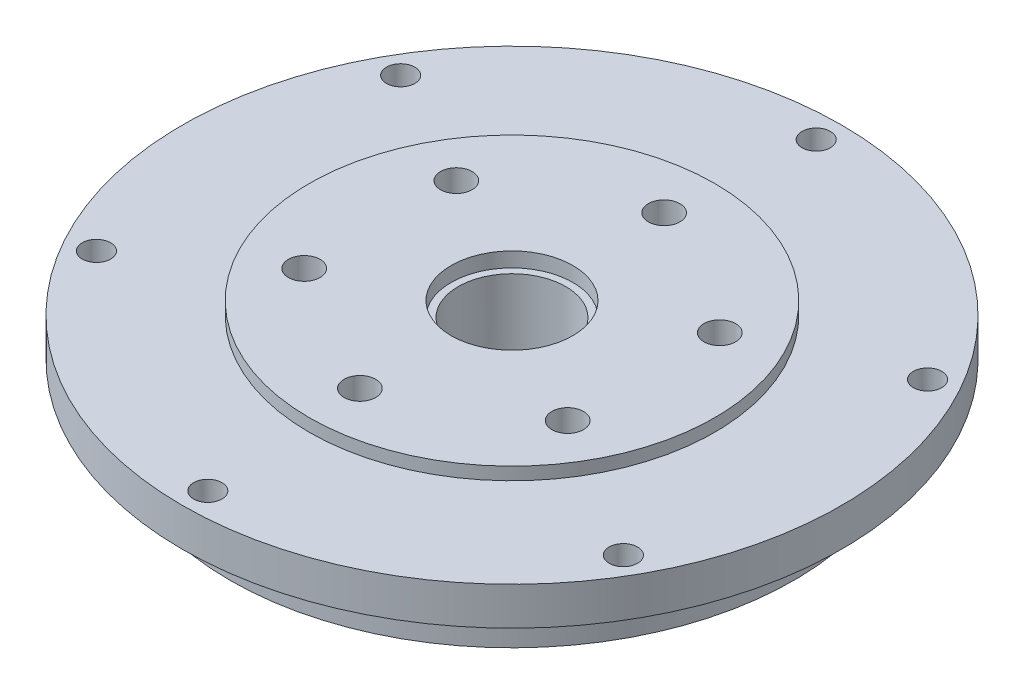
SolidWorks part; units mm, degrees
ref_plane "Front Plane" through (0, 0, 0) normal (0, 0, 1) x (1, 0, 0)
ref_plane "Top Plane" through (0, 0, 0) normal (0, 1, 0) x (1, 0, 0)
ref_plane "Right Plane" through (0, 0, 0) normal (1, 0, 0) x (0, 0, -1)
sketch "Sketch1" plane through (0, 0, 0) normal (0, 0, 1) x (1, 0, 0)
  line L0 (0, 77.3658) -> (0, -62.8959) construction
  line L1 (13.462, 21.717) -> (15.24, 21.717)
  line L2 (13.462, 0) -> (13.462, 21.717)
  line L3 (15.24, 21.717) -> (15.24, 25.4)
  line L4 (50.8, 25.4) -> (15.24, 25.4)
  line L6 (50.8, 25.4) -> (50.8, 22.225)
  line L7 (50.8, 22.225) -> (82.55, 22.225)
  line L8 (82.55, 22.225) -> (82.55, 12.7)
  line L9 (82.55, 12.7) -> (70.612, 12.7)
  line L10 (70.612, 12.7) -> (70.612, 8.8138)
  line L11 (70.612, 8.8138) -> (67.564, 8.8138)
  line L12 (67.564, 8.8138) -> (67.564, 4.7498)
  line L13 (67.564, 4.7498) -> (70.612, 4.7498)
  line L14 (70.612, 4.7498) -> (70.612, 0)
  line L15 (70.612, 0) -> (13.462, 0)
  dimension "D1" = 13.462
  dimension "D2" = 15.24
  dimension "D3" = 25.4
  dimension "D4" = 3.683
  dimension "D7" = 3.175
  dimension "D8" = 50.8
  dimension "D9" = 82.55
  dimension "D10" = 9.525
  dimension "D11" = 4.064
  dimension "D12" = 70.612
  dimension "D13" = 3.048
  dimension "D14" = 4.7498
revolve "Revolve1" add sketch "Sketch1" angle 360 about L0
sketch "Sketch2" plane through (0, 22.225, 0) normal (0, 1, 0) x (-1, 0, 0)
  circle A0 centre (0, -76.2) radius 3.556
  dimension "D1" = 7.112
  dimension "D2" = 76.2
extrude "Cut-Extrude1" cut sketch "Sketch2" against normal through all
pattern_circular "CirPattern1" count 6 over 360 about axis through (0, 0, 0) along (0, 1, 0) of "Cut-Extrude1"
sketch "Sketch3" plane through (0, 25.4, 0) normal (0, 1, 0) x (-1, 0, 0)
  circle A0 centre (0, -38.1) radius 3.9624
  dimension "D1" = 7.9248
  dimension "D2" = 38.1
extrude "Cut-Extrude2" cut sketch "Sketch3" against normal blind 19.05
pattern_circular "CirPattern2" count 6 over 360 about axis through (0, 0, 0) along (0, 1, 0) of "Cut-Extrude2"
sketch "Sketch4" plane through (0, 0, 0) normal (0, -1, 0) x (1, 0, 0)
  circle A0 centre (57.15, 0) radius 3.9624
  dimension "D1" = 7.9248
  dimension "D2" = 57.15
extrude "Cut-Extrude3" cut sketch "Sketch4" against normal blind 19.05
pattern_circular "CirPattern3" count 6 over 360 about axis through (0, 0, 0) along (0, 1, 0) of "Cut-Extrude3"
sketch "Sketch6" plane through (0, 0, 0) normal (0, -1, 0) x (1, 0, 0)
  circle A0 centre (0, 0) radius 63.5635
  dimension "D1" = 127.127
extrude "Cut-Extrude5" cut sketch "Sketch6" against normal blind 3.175
